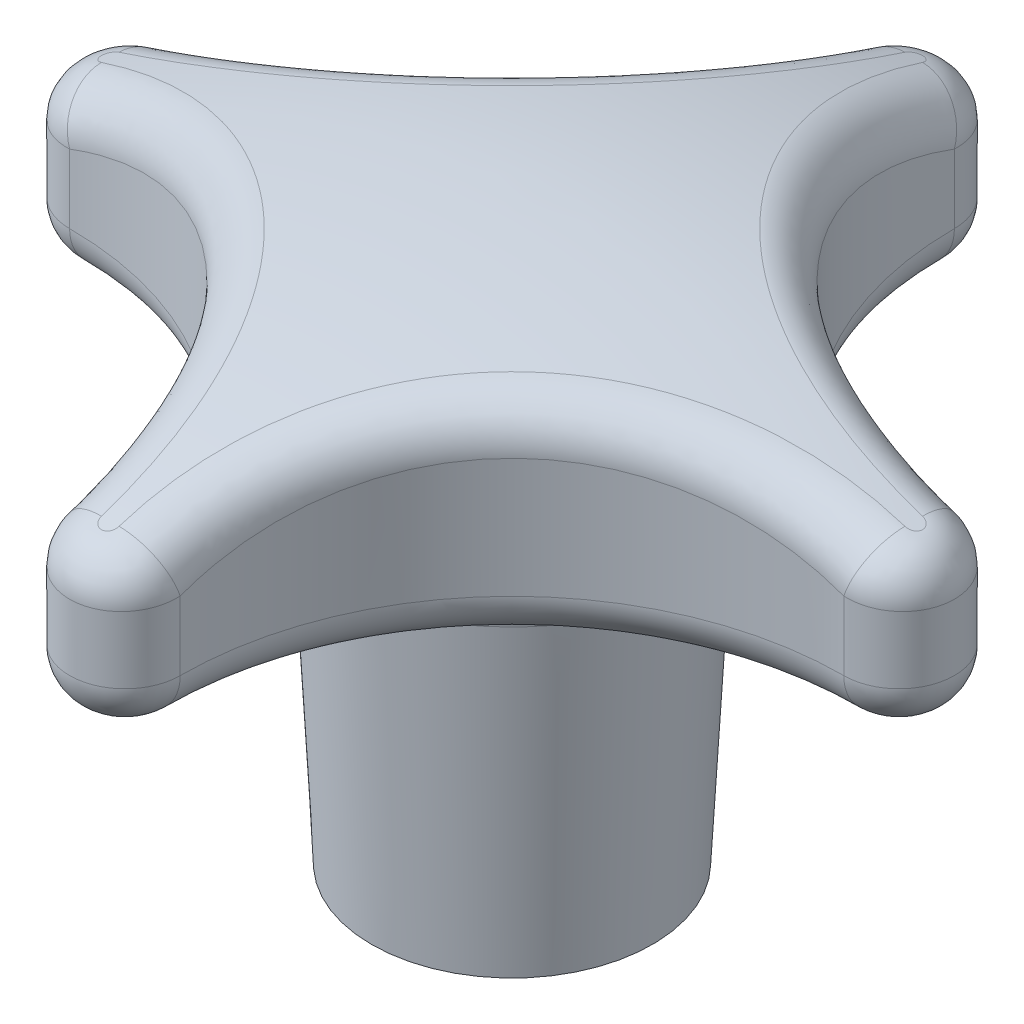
SolidWorks part; units mm, degrees
ref_plane "Front Plane" through (0, 0, 0) normal (0, 0, 1) x (1, 0, 0)
ref_plane "Top Plane" through (0, 0, 0) normal (0, 1, 0) x (1, 0, 0)
ref_plane "Right Plane" through (0, 0, 0) normal (1, 0, 0) x (0, 0, -1)
sketch "Sketch1" plane through (0, 0, 0) normal (0, 1, 0) x (1, 0, 0)
  circle A0 centre (0, 0) radius 10
  dimension "D1" = 20
extrude "Extrude1" add sketch "Sketch1" against normal blind 24
draft "Draft1" type of draft neutral plane draft angle 3 faces to draft 1 parameters "D1"=3
sketch "Sketch2" plane through (0, 0, 0) normal (0, 0, 1) x (1, 0, 0)
  line L0 (0, 0) -> (-31.5, 0)
  line L1 (-31.5, 0) -> (-31.5, 10.4)
  line L2 (0, 0) -> (0, 50000) construction
  line L3 (0, 16) -> (20.2547, 16) construction
  line L4 (0, 0) -> (0, 16)
  arc A0 (0, 16) -> (-31.5, 10.4) centre (0, -75.3938) ccw
revolve "Revolve1" add sketch "Sketch2" angle 360 about L2
sketch "Sketch4" plane through (0, 0, 0) normal (0, 1, 0) x (1, 0, 0)
  line L0 (0, 0) -> (-50000, 0) construction
  line L1 (0, 0) -> (0, 50000) construction
  line L2 (-27.5625, 3.9375) -> (-45.9117, 3.9375) construction
  line L3 (-3.9375, 27.5625) -> (-3.9375, 40.3224) construction
  arc A0 (0, 31.5) -> (-3.9375, 27.5625) centre (0, 27.5625) ccw
  arc A1 (-27.5625, 3.9375) -> (-31.5, 0) centre (-27.5625, 0) ccw
  circle A2 centre (0, 0) radius 31.5 construction
  arc A3 (-27.5625, 3.9375) -> (-3.9375, 27.5625) centre (-27.5625, 27.5625) ccw
  arc A4 (0, 31.5) -> (-31.5, 0) centre (-31.5, 31.5) ccw
  point P9 (0, 31.5)
  point P10 (-31.5, 0)
  point P13 (-3.9375, 27.5625)
  point P14 (-27.5625, 3.9375)
extrude "Extrude3" cut sketch "Sketch4" along normal through all
pattern_circular "CirPattern1" count 4 over 360 about axis through (0, 0, 0) along (0, 1, 0) of "Extrude3"
fillet "Fillet2" radius 3.3333 16 edges at (0, 0, 31.5) (10.8571, 0, 10.8571) (31.5, 0, 0) (10.8571, 0, -10.8571) (0, 0, -31.5) (-10.8571, 0, -10.8571) (-31.5, 0, 0) (-0.0002, 10.4, 31.5) (13.2545, 14.6082, 8.763) (31.5, 10.4, 0.0002) (8.763, 14.6082, -13.2545) (0.0002, 10.4, -31.5) (-13.2545, 14.6082, -8.763) (-31.5, 10.4, 0.0002) (-10.8571, 0, 10.8571) (-8.763, 14.6082, 13.2545)
fillet "Fillet3" radius 1.6667 1 edges at (0, 0, 11.2578)
sketch "Sketch6" [suppressed] plane through (0, -30, 0) normal (0, -1, 0) x (1, 0, 0)
  circle A0 centre (0, 0) radius 8
  dimension "D1" = 8
extrude "Extrude5" [suppressed] cut sketch "Sketch6" against normal blind 18
sketch "Sketch7" [suppressed] plane through (0, 0, 0) normal (0, 0, 1) x (1, 0, 0)
  line L0 (0, 2) -> (8, 2)
  line L1 (8, -30) -> (8, 2) construction
  line L2 (8, 2) -> (0, 6.6188)
  line L3 (0, 6.6188) -> (0, 2)
  line L4 (-8, -30) -> (8, -30) construction
revolve "Cut-Revolve1" [suppressed] cut sketch "Sketch7" angle 360 about L3
sketch "Sketch8" [suppressed] plane through (0, -24, 0) normal (0, -1, 0) x (1, 0, 0)
  circle A0 centre (0, 0) radius 6
  dimension "D1" = 12
extrude "Extrude6" [suppressed] cut sketch "Sketch8" against normal blind 28
sketch "Sketch9" [suppressed] plane through (0, -4, 0) normal (0, -1, 0) x (1, 0, 0)
  circle A0 centre (0, 0) radius 6.5
  dimension "D1" = 8.4
extrude "Extrude7" [suppressed] cut sketch "Sketch9" against normal through all
sketch "Sketch10" plane through (0, -24, 0) normal (0, -1, 0) x (1, 0, 0)
  circle A0 centre (0, 0) radius 6
extrude "Extrude8" cut sketch "Sketch10" against normal blind 22
sketch "Sketch11" plane through (0, 0, 0) normal (0, 0, 1) x (1, 0, 0)
  line L0 (5.1, 7.0555) -> (5.1, -2)
  line L1 (0, 0) -> (0, -5.4531) construction
  line L2 (5.1, 7.0555) -> (0, 10)
  line L3 (0, 10) -> (0, -2)
  line L4 (-6, -2) -> (6, -2) construction
  line L5 (5.1, -2) -> (0, -2)
revolve "Cut-Revolve2" cut sketch "Sketch11" angle 360 about L3
equation "\"D2@Sketch2\" = \"D1@Sketch2\"*.65"
equation "\"D1@Sketch4\" = (\"D3@Sketch2\"*2)/8"
equation "\"D2@Sketch4\" =( \"D3@Sketch2\"*2)/8"
equation "\"D1@Sketch7\" = \"D1@Extrude5\""
equation "\"D1@Fillet3\" = \"D1@Fillet2\"/2"
equation "\"D2@Sketch11\" = \"D1@Sketch10\""
